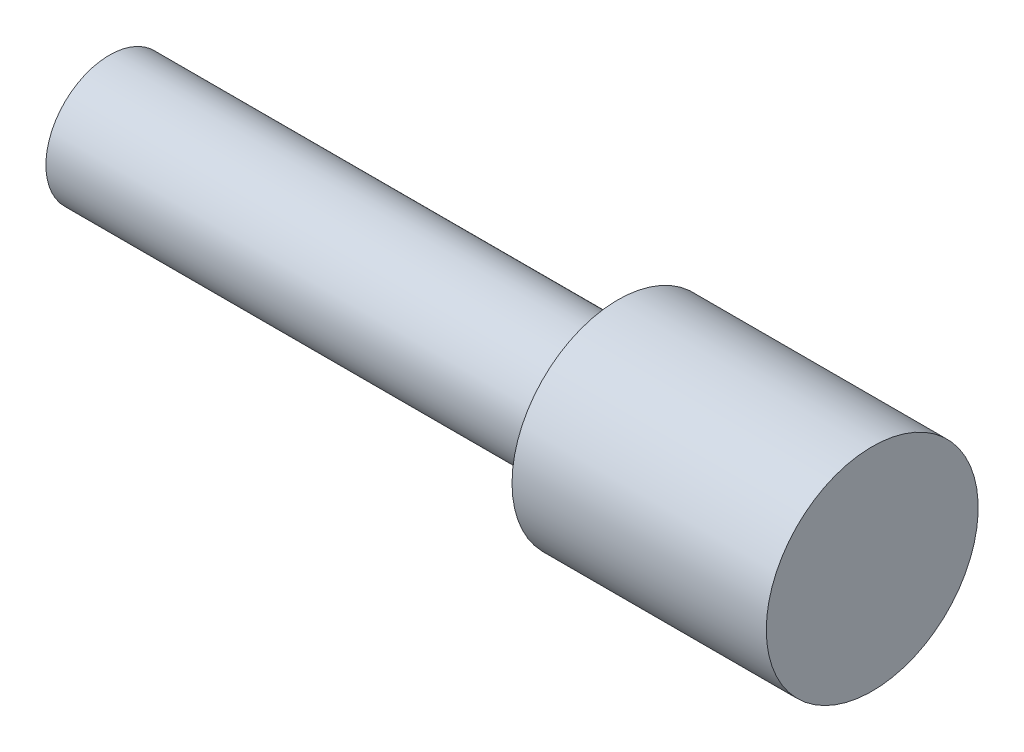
SolidWorks part; units mm, degrees
ref_plane "Front Plane" through (0, 0, 0) normal (0, 0, 1) x (1, 0, 0)
ref_plane "Top Plane" through (0, 0, 0) normal (0, 1, 0) x (1, 0, 0)
ref_plane "Right Plane" through (0, 0, 0) normal (1, 0, 0) x (0, 0, -1)
sketch "Sketch1" plane through (0, 0, 0) normal (1, 0, 0) x (0, 0, -1)
  circle A0 centre (0, 0) radius 19.05
  dimension "D1" = 38.1
extrude "Boss-Extrude1" add sketch "Sketch1" against normal blind 152.4
sketch "Sketch2" plane through (0, 0, 0) normal (1, 0, 0) x (0, 0, -1)
  circle A0 centre (0, 0) radius 31.75
  dimension "D1" = 63.5
extrude "Boss-Extrude2" add sketch "Sketch2" along normal blind 76.2
